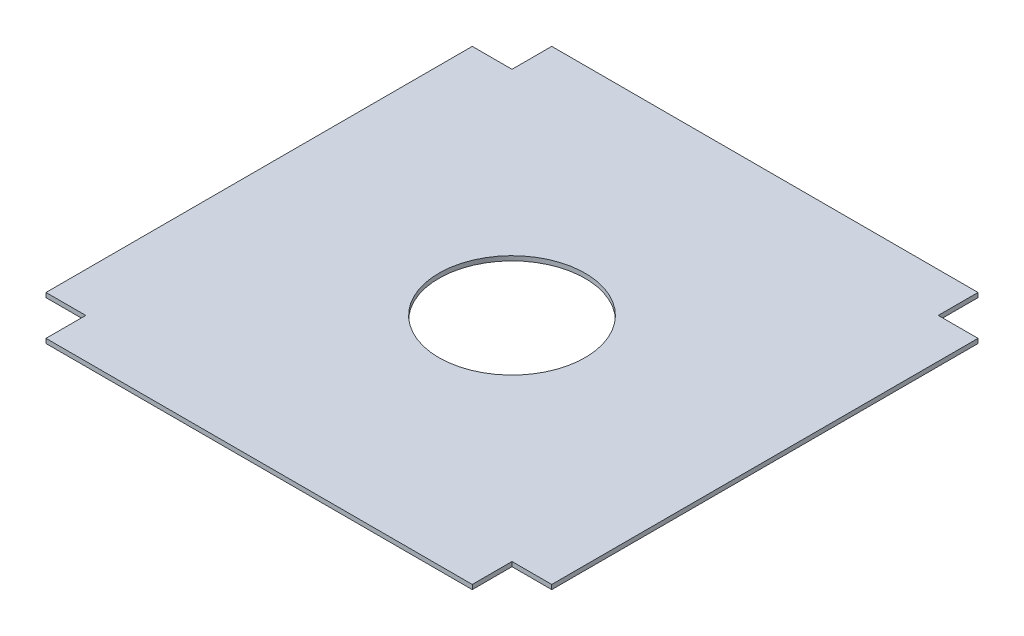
SolidWorks part; units mm, degrees
ref_plane "Front Plane" through (0, 0, 0) normal (0, 0, 1) x (1, 0, 0)
ref_plane "Top Plane" through (0, 0, 0) normal (0, 1, 0) x (1, 0, 0)
ref_plane "Right Plane" through (0, 0, 0) normal (1, 0, 0) x (0, 0, -1)
sketch "Sketch2" plane through (0, 0, 0) normal (0, 1, 0) x (1, 0, 0)
  line L0 (-177.8, 0) -> (177.8, 0) construction
  line L1 (-177.8, 177.8) -> (177.8, 177.8)
  line L2 (-177.8, 177.8) -> (-177.8, -177.8)
  line L3 (-177.8, -177.8) -> (177.8, -177.8)
  line L4 (177.8, 177.8) -> (177.8, -177.8)
  line L5 (-177.8, 177.8) -> (177.8, -177.8) construction
  line L6 (-177.8, -177.8) -> (177.8, 177.8) construction
  line L7 (-177.8, 177.8) -> (-149.86, 177.8)
  line L8 (-177.8, 177.8) -> (-177.8, 149.86)
  line L9 (-177.8, 149.86) -> (-149.86, 149.86)
  line L10 (-149.86, 177.8) -> (-149.86, 149.86)
  line L11 (177.8, 177.8) -> (149.86, 177.8)
  line L12 (177.8, 177.8) -> (177.8, 149.86)
  line L13 (177.8, 149.86) -> (149.86, 149.86)
  line L14 (149.86, 177.8) -> (149.86, 149.86)
  line L15 (149.86, -177.8) -> (149.86, -149.86)
  line L16 (177.8, -149.86) -> (149.86, -149.86)
  line L17 (-149.86, -177.8) -> (-149.86, -149.86)
  line L18 (-177.8, -149.86) -> (-149.86, -149.86)
  circle A0 centre (0, 0) radius 51.435
  point P0 (0, 0)
  dimension "D3" = 102.87
  dimension "D1" = 355.6
  dimension "D2" = 355.6
  dimension "D4" = 27.94
  dimension "D5" = 27.94
extrude "Boss-Extrude2" add sketch "Sketch2" along normal blind 3.175 contours L2 L18 L17 L3 L15 L16 L4 L13 L14 L1 L10 L9 A0
